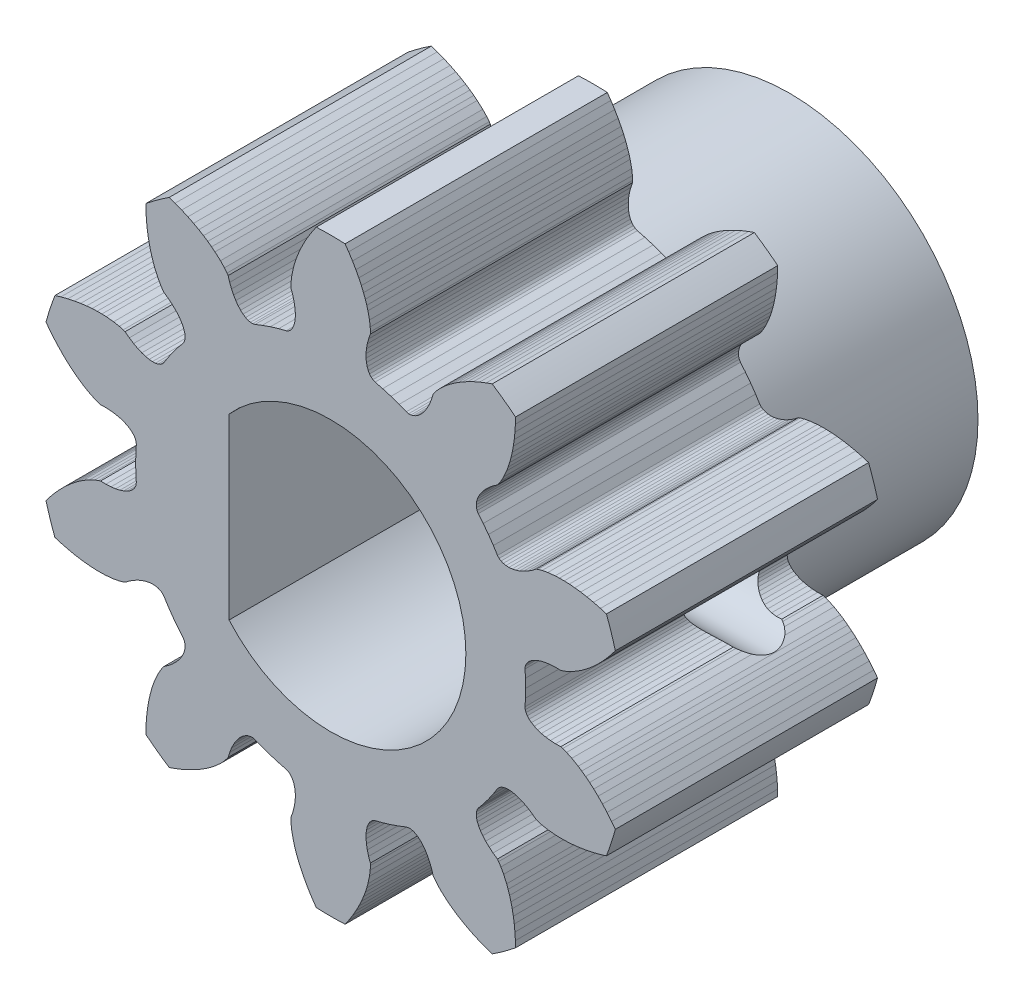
SolidWorks part; units mm, degrees
ref_plane "Piano frontale" through (0, 0, 0) normal (0, 0, 1) x (1, 0, 0)
ref_plane "Piano superiore" through (0, 0, 0) normal (0, 1, 0) x (1, 0, 0)
ref_plane "Piano destro" through (0, 0, 0) normal (1, 0, 0) x (0, 0, -1)
sketch "Model" plane through (0, 0, 0) normal (0, 0, 1) x (1, 0, 0)
  line L0 (84.3643, -6.8229) -> (84.3777, -6.6052)
  line L1 (84.3777, -6.6052) -> (84.399, -6.4007)
  line L2 (84.399, -6.4007) -> (84.427, -6.2092)
  line L3 (84.427, -6.2092) -> (84.4609, -6.0306)
  line L4 (84.4609, -6.0306) -> (84.499, -5.8673)
  line L5 (84.499, -5.8673) -> (84.5407, -5.7174)
  line L6 (84.5407, -5.7174) -> (84.5853, -5.5797)
  line L7 (84.5853, -5.5797) -> (84.6311, -5.4559)
  line L8 (84.6311, -5.4559) -> (84.7223, -5.2499)
  line L9 (84.7223, -5.2499) -> (84.8061, -5.0966)
  line L10 (84.8061, -5.0966) -> (84.8759, -4.9906)
  line L11 (84.8759, -4.9906) -> (84.9127, -4.9427)
  line L12 (84.9127, -4.9427) -> (85.0453, -4.8498)
  line L13 (85.0453, -4.8498) -> (85.1666, -4.7509)
  line L14 (85.1666, -4.7509) -> (85.2712, -4.6509)
  line L15 (85.2712, -4.6509) -> (85.359, -4.551)
  line L16 (85.359, -4.551) -> (85.4304, -4.4523)
  line L17 (85.4304, -4.4523) -> (85.4856, -4.3562)
  line L18 (85.4856, -4.3562) -> (85.525, -4.2638)
  line L19 (85.525, -4.2638) -> (85.549, -4.1762)
  line L20 (85.549, -4.1762) -> (85.5581, -4.0946)
  line L21 (85.5581, -4.0946) -> (85.5528, -4.02)
  line L22 (85.5528, -4.02) -> (85.5338, -3.9534)
  line L23 (85.5338, -3.9534) -> (85.4968, -3.8895)
  line L24 (85.4968, -3.8895) -> (85.346, -3.7071)
  line L25 (85.346, -3.7071) -> (85.1863, -3.4973)
  line L26 (85.1863, -3.4973) -> (85.0362, -3.2807)
  line L27 (85.0362, -3.2807) -> (84.9093, -3.0809)
  line L28 (84.9093, -3.0809) -> (84.8599, -3.026)
  line L29 (84.8599, -3.026) -> (84.8025, -2.9873)
  line L30 (84.8025, -2.9873) -> (84.7332, -2.9592)
  line L31 (84.7332, -2.9592) -> (84.6527, -2.9426)
  line L32 (84.6527, -2.9426) -> (84.562, -2.9384)
  line L33 (84.562, -2.9384) -> (84.462, -2.9473)
  line L34 (84.462, -2.9473) -> (84.3535, -2.9701)
  line L35 (84.3535, -2.9701) -> (84.2376, -3.0075)
  line L36 (84.2376, -3.0075) -> (84.1154, -3.0602)
  line L37 (84.1154, -3.0602) -> (83.988, -3.1287)
  line L38 (83.988, -3.1287) -> (83.8564, -3.2135)
  line L39 (83.8564, -3.2135) -> (83.7272, -3.3109)
  line L40 (83.7272, -3.3109) -> (83.6702, -3.3312)
  line L41 (83.6702, -3.3312) -> (83.5478, -3.3648)
  line L42 (83.5478, -3.3648) -> (83.3761, -3.397)
  line L43 (83.3761, -3.397) -> (83.152, -3.4201)
  line L44 (83.152, -3.4201) -> (83.0202, -3.4255)
  line L45 (83.0202, -3.4255) -> (82.8754, -3.4254)
  line L46 (82.8754, -3.4254) -> (82.72, -3.4187)
  line L47 (82.72, -3.4187) -> (82.5529, -3.4045)
  line L48 (82.5529, -3.4045) -> (82.3725, -3.3815)
  line L49 (82.3725, -3.3815) -> (82.1818, -3.349)
  line L50 (82.1818, -3.349) -> (81.9807, -3.306)
  line L51 (81.9807, -3.306) -> (81.7695, -3.2515)
  line L52 (81.7695, -3.2515) -> (81.5869, -3.1966)
  line L53 (81.3147, -2.359) -> (81.4302, -2.2072)
  line L54 (81.4302, -2.2072) -> (81.569, -2.039)
  line L55 (81.569, -2.039) -> (81.7064, -1.8861)
  line L56 (81.7064, -1.8861) -> (81.8417, -1.7476)
  line L57 (81.8417, -1.7476) -> (81.9741, -1.6231)
  line L58 (81.9741, -1.6231) -> (82.1009, -1.5133)
  line L59 (82.1009, -1.5133) -> (82.2227, -1.4165)
  line L60 (82.2227, -1.4165) -> (82.3397, -1.3313)
  line L61 (82.3397, -1.3313) -> (82.4496, -1.2582)
  line L62 (82.4496, -1.2582) -> (82.6445, -1.1451)
  line L63 (82.6445, -1.1451) -> (82.8023, -1.0703)
  line L64 (82.8023, -1.0703) -> (82.921, -1.0256)
  line L65 (82.921, -1.0256) -> (82.979, -1.0085)
  line L66 (82.979, -1.0085) -> (83.1409, -1.0113)
  line L67 (83.1409, -1.0113) -> (83.2972, -1.0026)
  line L68 (83.2972, -1.0026) -> (83.4406, -0.9831)
  line L69 (83.4406, -0.9831) -> (83.5704, -0.9539)
  line L70 (83.5704, -0.9539) -> (83.6861, -0.9161)
  line L71 (83.6861, -0.9161) -> (83.7873, -0.8708)
  line L72 (83.7873, -0.8708) -> (83.8735, -0.8192)
  line L73 (83.8735, -0.8192) -> (83.9443, -0.7624)
  line L74 (83.9443, -0.7624) -> (83.9997, -0.7017)
  line L75 (83.9997, -0.7017) -> (84.0392, -0.6382)
  line L76 (84.0392, -0.6382) -> (84.063, -0.5732)
  line L77 (84.063, -0.5732) -> (84.0707, -0.4998)
  line L78 (84.0707, -0.4998) -> (84.0558, -0.2635)
  line L79 (84.0558, -0.2635) -> (84.05, 0)
  line L80 (84.05, 0) -> (84.0558, 0.2635)
  line L81 (84.0558, 0.2635) -> (84.0707, 0.4998)
  line L82 (84.0707, 0.4998) -> (84.063, 0.5732)
  line L83 (84.063, 0.5732) -> (84.0392, 0.6382)
  line L84 (84.0392, 0.6382) -> (83.9997, 0.7017)
  line L85 (83.9997, 0.7017) -> (83.9443, 0.7624)
  line L86 (83.9443, 0.7624) -> (83.8735, 0.8192)
  line L87 (83.8735, 0.8192) -> (83.7873, 0.8708)
  line L88 (83.7873, 0.8708) -> (83.6861, 0.9161)
  line L89 (83.6861, 0.9161) -> (83.5704, 0.9539)
  line L90 (83.5704, 0.9539) -> (83.4406, 0.9831)
  line L91 (83.4406, 0.9831) -> (83.2972, 1.0026)
  line L92 (83.2972, 1.0026) -> (83.1409, 1.0113)
  line L93 (83.1409, 1.0113) -> (82.979, 1.0085)
  line L94 (82.979, 1.0085) -> (82.921, 1.0256)
  line L95 (82.921, 1.0256) -> (82.8023, 1.0703)
  line L96 (82.8023, 1.0703) -> (82.6445, 1.1451)
  line L97 (82.6445, 1.1451) -> (82.4496, 1.2582)
  line L98 (82.4496, 1.2582) -> (82.3397, 1.3313)
  line L99 (82.3397, 1.3313) -> (82.2227, 1.4165)
  line L100 (82.2227, 1.4165) -> (82.1009, 1.5133)
  line L101 (82.1009, 1.5133) -> (81.9741, 1.6231)
  line L102 (81.9741, 1.6231) -> (81.8417, 1.7476)
  line L103 (81.8417, 1.7476) -> (81.7064, 1.8861)
  line L104 (81.7064, 1.8861) -> (81.569, 2.039)
  line L105 (81.569, 2.039) -> (81.4302, 2.2072)
  line L106 (81.4302, 2.2072) -> (81.3147, 2.359)
  line L107 (81.5869, 3.1966) -> (81.7695, 3.2515)
  line L108 (81.7695, 3.2515) -> (81.9807, 3.306)
  line L109 (81.9807, 3.306) -> (82.1818, 3.349)
  line L110 (82.1818, 3.349) -> (82.3725, 3.3815)
  line L111 (82.3725, 3.3815) -> (82.5529, 3.4045)
  line L112 (82.5529, 3.4045) -> (82.72, 3.4187)
  line L113 (82.72, 3.4187) -> (82.8754, 3.4254)
  line L114 (82.8754, 3.4254) -> (83.0202, 3.4255)
  line L115 (83.0202, 3.4255) -> (83.152, 3.4201)
  line L116 (83.152, 3.4201) -> (83.3761, 3.397)
  line L117 (83.3761, 3.397) -> (83.5478, 3.3648)
  line L118 (83.5478, 3.3648) -> (83.6702, 3.3312)
  line L119 (83.6702, 3.3312) -> (83.7272, 3.3109)
  line L120 (83.7272, 3.3109) -> (83.8564, 3.2135)
  line L121 (83.8564, 3.2135) -> (83.988, 3.1287)
  line L122 (83.988, 3.1287) -> (84.1154, 3.0602)
  line L123 (84.1154, 3.0602) -> (84.2376, 3.0075)
  line L124 (84.2376, 3.0075) -> (84.3535, 2.9701)
  line L125 (84.3535, 2.9701) -> (84.462, 2.9473)
  line L126 (84.462, 2.9473) -> (84.562, 2.9384)
  line L127 (84.562, 2.9384) -> (84.6527, 2.9426)
  line L128 (84.6527, 2.9426) -> (84.7332, 2.9592)
  line L129 (84.7332, 2.9592) -> (84.8025, 2.9873)
  line L130 (84.8025, 2.9873) -> (84.8599, 3.026)
  line L131 (84.8599, 3.026) -> (84.9093, 3.0809)
  line L132 (84.9093, 3.0809) -> (85.0362, 3.2807)
  line L133 (85.0362, 3.2807) -> (85.1863, 3.4973)
  line L134 (85.1863, 3.4973) -> (85.346, 3.7071)
  line L135 (85.346, 3.7071) -> (85.4968, 3.8895)
  line L136 (85.4968, 3.8895) -> (85.5338, 3.9534)
  line L137 (85.5338, 3.9534) -> (85.5528, 4.02)
  line L138 (85.5528, 4.02) -> (85.5581, 4.0946)
  line L139 (85.5581, 4.0946) -> (85.549, 4.1762)
  line L140 (85.549, 4.1762) -> (85.525, 4.2638)
  line L141 (85.525, 4.2638) -> (85.4856, 4.3562)
  line L142 (85.4856, 4.3562) -> (85.4304, 4.4523)
  line L143 (85.4304, 4.4523) -> (85.359, 4.551)
  line L144 (85.359, 4.551) -> (85.2712, 4.6509)
  line L145 (85.2712, 4.6509) -> (85.1666, 4.7509)
  line L146 (85.1666, 4.7509) -> (85.0453, 4.8498)
  line L147 (85.0453, 4.8498) -> (84.9127, 4.9427)
  line L148 (84.9127, 4.9427) -> (84.8759, 4.9906)
  line L149 (84.8759, 4.9906) -> (84.8061, 5.0966)
  line L150 (84.8061, 5.0966) -> (84.7223, 5.2499)
  line L151 (84.7223, 5.2499) -> (84.6311, 5.4559)
  line L152 (84.6311, 5.4559) -> (84.5853, 5.5797)
  line L153 (84.5853, 5.5797) -> (84.5407, 5.7174)
  line L154 (84.5407, 5.7174) -> (84.499, 5.8673)
  line L155 (84.499, 5.8673) -> (84.4609, 6.0306)
  line L156 (84.4609, 6.0306) -> (84.427, 6.2092)
  line L157 (84.427, 6.2092) -> (84.399, 6.4007)
  line L158 (84.399, 6.4007) -> (84.3777, 6.6052)
  line L159 (84.3777, 6.6052) -> (84.3643, 6.8229)
  line L160 (84.3643, 6.8229) -> (84.36, 7.0135)
  line L161 (85.0726, 7.5312) -> (85.2526, 7.4683)
  line L162 (85.2526, 7.4683) -> (85.4555, 7.3882)
  line L163 (85.4555, 7.3882) -> (85.6434, 7.3048)
  line L164 (85.6434, 7.3048) -> (85.8168, 7.219)
  line L165 (85.8168, 7.219) -> (85.9762, 7.1316)
  line L166 (85.9762, 7.1316) -> (86.1198, 7.0448)
  line L167 (86.1198, 7.0448) -> (86.2495, 6.9589)
  line L168 (86.2495, 6.9589) -> (86.3667, 6.8739)
  line L169 (86.3667, 6.8739) -> (86.4702, 6.7921)
  line L170 (86.4702, 6.7921) -> (86.6379, 6.6417)
  line L171 (86.6379, 6.6417) -> (86.7578, 6.5147)
  line L172 (86.7578, 6.5147) -> (86.8371, 6.4155)
  line L173 (86.8371, 6.4155) -> (86.8713, 6.3657)
  line L174 (86.8713, 6.3657) -> (86.9186, 6.2109)
  line L175 (86.9186, 6.2109) -> (86.9752, 6.0649)
  line L176 (86.9752, 6.0649) -> (87.038, 5.9346)
  line L177 (87.038, 5.9346) -> (87.1059, 5.8201)
  line L178 (87.1059, 5.8201) -> (87.1776, 5.7218)
  line L179 (87.1776, 5.7218) -> (87.252, 5.6396)
  line L180 (87.252, 5.6396) -> (87.3277, 5.5735)
  line L181 (87.3277, 5.5735) -> (87.4036, 5.5237)
  line L182 (87.4036, 5.5237) -> (87.4785, 5.4898)
  line L183 (87.4785, 5.4898) -> (87.5511, 5.4718)
  line L184 (87.5511, 5.4718) -> (87.6202, 5.4693)
  line L185 (87.6202, 5.4693) -> (87.6924, 5.4847)
  line L186 (87.6924, 5.4847) -> (87.9125, 5.5718)
  line L187 (87.9125, 5.5718) -> (88.1613, 5.6588)
  line L188 (88.1613, 5.6588) -> (88.4138, 5.7347)
  line L189 (88.4138, 5.7347) -> (88.643, 5.7936)
  line L190 (88.643, 5.7936) -> (88.7105, 5.8236)
  line L191 (88.7105, 5.8236) -> (88.765, 5.8662)
  line L192 (88.765, 5.8662) -> (88.8131, 5.9235)
  line L193 (88.8131, 5.9235) -> (88.8538, 5.9949)
  line L194 (88.8538, 5.9949) -> (88.8859, 6.0798)
  line L195 (88.8859, 6.0798) -> (88.9083, 6.1777)
  line L196 (88.9083, 6.1777) -> (88.9202, 6.2879)
  line L197 (88.9202, 6.2879) -> (88.9204, 6.4097)
  line L198 (88.9204, 6.4097) -> (88.908, 6.5422)
  line L199 (88.908, 6.5422) -> (88.8823, 6.6846)
  line L200 (88.8823, 6.6846) -> (88.8422, 6.8359)
  line L201 (88.8422, 6.8359) -> (88.7895, 6.989)
  line L202 (88.7895, 6.989) -> (88.7879, 7.0494)
  line L203 (88.7879, 7.0494) -> (88.7937, 7.1762)
  line L204 (88.7937, 7.1762) -> (88.8161, 7.3494)
  line L205 (88.8161, 7.3494) -> (88.8634, 7.5697)
  line L206 (88.8634, 7.5697) -> (88.899, 7.6967)
  line L207 (88.899, 7.6967) -> (88.9439, 7.8344)
  line L208 (88.9439, 7.8344) -> (88.9983, 7.9801)
  line L209 (88.9983, 7.9801) -> (89.0635, 8.1347)
  line L210 (89.0635, 8.1347) -> (89.141, 8.2991)
  line L211 (89.141, 8.2991) -> (89.2309, 8.4705)
  line L212 (89.2309, 8.4705) -> (89.3339, 8.6484)
  line L213 (89.3339, 8.6484) -> (89.451, 8.8325)
  line L214 (89.451, 8.8325) -> (89.5596, 8.9892)
  line L215 (90.4404, 8.9892) -> (90.549, 8.8325)
  line L216 (90.549, 8.8325) -> (90.6661, 8.6484)
  line L217 (90.6661, 8.6484) -> (90.7691, 8.4705)
  line L218 (90.7691, 8.4705) -> (90.859, 8.2991)
  line L219 (90.859, 8.2991) -> (90.9365, 8.1347)
  line L220 (90.9365, 8.1347) -> (91.0017, 7.9801)
  line L221 (91.0017, 7.9801) -> (91.0561, 7.8344)
  line L222 (91.0561, 7.8344) -> (91.101, 7.6967)
  line L223 (91.101, 7.6967) -> (91.1366, 7.5697)
  line L224 (91.1366, 7.5697) -> (91.1839, 7.3494)
  line L225 (91.1839, 7.3494) -> (91.2063, 7.1762)
  line L226 (91.2063, 7.1762) -> (91.2121, 7.0494)
  line L227 (91.2121, 7.0494) -> (91.2105, 6.989)
  line L228 (91.2105, 6.989) -> (91.1578, 6.8359)
  line L229 (91.1578, 6.8359) -> (91.1177, 6.6846)
  line L230 (91.1177, 6.6846) -> (91.092, 6.5422)
  line L231 (91.092, 6.5422) -> (91.0796, 6.4097)
  line L232 (91.0796, 6.4097) -> (91.0798, 6.2879)
  line L233 (91.0798, 6.2879) -> (91.0917, 6.1777)
  line L234 (91.0917, 6.1777) -> (91.1141, 6.0798)
  line L235 (91.1141, 6.0798) -> (91.1462, 5.9949)
  line L236 (91.1462, 5.9949) -> (91.1869, 5.9235)
  line L237 (91.1869, 5.9235) -> (91.235, 5.8662)
  line L238 (91.235, 5.8662) -> (91.2895, 5.8236)
  line L239 (91.2895, 5.8236) -> (91.357, 5.7936)
  line L240 (91.357, 5.7936) -> (91.5862, 5.7347)
  line L241 (91.5862, 5.7347) -> (91.8387, 5.6588)
  line L242 (91.8387, 5.6588) -> (92.0875, 5.5718)
  line L243 (92.0875, 5.5718) -> (92.3076, 5.4847)
  line L244 (92.3076, 5.4847) -> (92.3798, 5.4693)
  line L245 (92.3798, 5.4693) -> (92.4489, 5.4718)
  line L246 (92.4489, 5.4718) -> (92.5215, 5.4898)
  line L247 (92.5215, 5.4898) -> (92.5964, 5.5237)
  line L248 (92.5964, 5.5237) -> (92.6723, 5.5735)
  line L249 (92.6723, 5.5735) -> (92.748, 5.6396)
  line L250 (92.748, 5.6396) -> (92.8224, 5.7218)
  line L251 (92.8224, 5.7218) -> (92.8941, 5.8201)
  line L252 (92.8941, 5.8201) -> (92.962, 5.9346)
  line L253 (92.962, 5.9346) -> (93.0248, 6.0649)
  line L254 (93.0248, 6.0649) -> (93.0814, 6.2109)
  line L255 (93.0814, 6.2109) -> (93.1287, 6.3657)
  line L256 (93.1287, 6.3657) -> (93.1629, 6.4155)
  line L257 (93.1629, 6.4155) -> (93.2422, 6.5147)
  line L258 (93.2422, 6.5147) -> (93.3621, 6.6417)
  line L259 (93.3621, 6.6417) -> (93.5298, 6.7921)
  line L260 (93.5298, 6.7921) -> (93.6333, 6.8739)
  line L261 (93.6333, 6.8739) -> (93.7505, 6.9589)
  line L262 (93.7505, 6.9589) -> (93.8802, 7.0448)
  line L263 (93.8802, 7.0448) -> (94.0238, 7.1316)
  line L264 (94.0238, 7.1316) -> (94.1832, 7.219)
  line L265 (94.1832, 7.219) -> (94.3566, 7.3048)
  line L266 (94.3566, 7.3048) -> (94.5445, 7.3882)
  line L267 (94.5445, 7.3882) -> (94.7474, 7.4683)
  line L268 (94.7474, 7.4683) -> (94.9274, 7.5312)
  line L269 (95.64, 7.0135) -> (95.6357, 6.8229)
  line L270 (95.6357, 6.8229) -> (95.6223, 6.6052)
  line L271 (95.6223, 6.6052) -> (95.601, 6.4007)
  line L272 (95.601, 6.4007) -> (95.573, 6.2092)
  line L273 (95.573, 6.2092) -> (95.5391, 6.0306)
  line L274 (95.5391, 6.0306) -> (95.501, 5.8673)
  line L275 (95.501, 5.8673) -> (95.4593, 5.7174)
  line L276 (95.4593, 5.7174) -> (95.4147, 5.5797)
  line L277 (95.4147, 5.5797) -> (95.3689, 5.4559)
  line L278 (95.3689, 5.4559) -> (95.2777, 5.2499)
  line L279 (95.2777, 5.2499) -> (95.1939, 5.0966)
  line L280 (95.1939, 5.0966) -> (95.1241, 4.9906)
  line L281 (95.1241, 4.9906) -> (95.0873, 4.9427)
  line L282 (95.0873, 4.9427) -> (94.9547, 4.8498)
  line L283 (94.9547, 4.8498) -> (94.8334, 4.7509)
  line L284 (94.8334, 4.7509) -> (94.7288, 4.6509)
  line L285 (94.7288, 4.6509) -> (94.641, 4.551)
  line L286 (94.641, 4.551) -> (94.5696, 4.4523)
  line L287 (94.5696, 4.4523) -> (94.5144, 4.3562)
  line L288 (94.5144, 4.3562) -> (94.475, 4.2638)
  line L289 (94.475, 4.2638) -> (94.451, 4.1762)
  line L290 (94.451, 4.1762) -> (94.4419, 4.0946)
  line L291 (94.4419, 4.0946) -> (94.4472, 4.02)
  line L292 (94.4472, 4.02) -> (94.4662, 3.9534)
  line L293 (94.4662, 3.9534) -> (94.5032, 3.8895)
  line L294 (94.5032, 3.8895) -> (94.654, 3.7071)
  line L295 (94.654, 3.7071) -> (94.8137, 3.4973)
  line L296 (94.8137, 3.4973) -> (94.9638, 3.2807)
  line L297 (94.9638, 3.2807) -> (95.0907, 3.0809)
  line L298 (95.0907, 3.0809) -> (95.1401, 3.026)
  line L299 (95.1401, 3.026) -> (95.1975, 2.9873)
  line L300 (95.1975, 2.9873) -> (95.2668, 2.9592)
  line L301 (95.2668, 2.9592) -> (95.3473, 2.9426)
  line L302 (95.3473, 2.9426) -> (95.438, 2.9384)
  line L303 (95.438, 2.9384) -> (95.538, 2.9473)
  line L304 (95.538, 2.9473) -> (95.6465, 2.9701)
  line L305 (95.6465, 2.9701) -> (95.7624, 3.0075)
  line L306 (95.7624, 3.0075) -> (95.8846, 3.0602)
  line L307 (95.8846, 3.0602) -> (96.012, 3.1287)
  line L308 (96.012, 3.1287) -> (96.1436, 3.2135)
  line L309 (96.1436, 3.2135) -> (96.2728, 3.3109)
  line L310 (96.2728, 3.3109) -> (96.3298, 3.3312)
  line L311 (96.3298, 3.3312) -> (96.4522, 3.3648)
  line L312 (96.4522, 3.3648) -> (96.6239, 3.397)
  line L313 (96.6239, 3.397) -> (96.848, 3.4201)
  line L314 (96.848, 3.4201) -> (96.9798, 3.4255)
  line L315 (96.9798, 3.4255) -> (97.1246, 3.4254)
  line L316 (97.1246, 3.4254) -> (97.28, 3.4187)
  line L317 (97.28, 3.4187) -> (97.4471, 3.4045)
  line L318 (97.4471, 3.4045) -> (97.6275, 3.3815)
  line L319 (97.6275, 3.3815) -> (97.8182, 3.349)
  line L320 (97.8182, 3.349) -> (98.0193, 3.306)
  line L321 (98.0193, 3.306) -> (98.2305, 3.2515)
  line L322 (98.2305, 3.2515) -> (98.4131, 3.1966)
  line L323 (98.6853, 2.359) -> (98.5698, 2.2072)
  line L324 (98.5698, 2.2072) -> (98.431, 2.039)
  line L325 (98.431, 2.039) -> (98.2936, 1.8861)
  line L326 (98.2936, 1.8861) -> (98.1583, 1.7476)
  line L327 (98.1583, 1.7476) -> (98.0259, 1.6231)
  line L328 (98.0259, 1.6231) -> (97.8991, 1.5133)
  line L329 (97.8991, 1.5133) -> (97.7773, 1.4165)
  line L330 (97.7773, 1.4165) -> (97.6603, 1.3313)
  line L331 (97.6603, 1.3313) -> (97.5504, 1.2582)
  line L332 (97.5504, 1.2582) -> (97.3555, 1.1451)
  line L333 (97.3555, 1.1451) -> (97.1977, 1.0703)
  line L334 (97.1977, 1.0703) -> (97.079, 1.0256)
  line L335 (97.079, 1.0256) -> (97.021, 1.0085)
  line L336 (97.021, 1.0085) -> (96.8591, 1.0113)
  line L337 (96.8591, 1.0113) -> (96.7028, 1.0026)
  line L338 (96.7028, 1.0026) -> (96.5594, 0.9831)
  line L339 (96.5594, 0.9831) -> (96.4296, 0.9539)
  line L340 (96.4296, 0.9539) -> (96.3139, 0.9161)
  line L341 (96.3139, 0.9161) -> (96.2127, 0.8708)
  line L342 (96.2127, 0.8708) -> (96.1265, 0.8192)
  line L343 (96.1265, 0.8192) -> (96.0557, 0.7624)
  line L344 (96.0557, 0.7624) -> (96.0003, 0.7017)
  line L345 (96.0003, 0.7017) -> (95.9608, 0.6382)
  line L346 (95.9608, 0.6382) -> (95.937, 0.5732)
  line L347 (95.937, 0.5732) -> (95.9293, 0.4998)
  line L348 (95.9293, 0.4998) -> (95.9442, 0.2635)
  line L349 (95.9442, 0.2635) -> (95.95, 0)
  line L350 (95.95, 0) -> (95.9442, -0.2635)
  line L351 (95.9442, -0.2635) -> (95.9293, -0.4998)
  line L352 (95.9293, -0.4998) -> (95.937, -0.5732)
  line L353 (95.937, -0.5732) -> (95.9608, -0.6382)
  line L354 (95.9608, -0.6382) -> (96.0003, -0.7017)
  line L355 (96.0003, -0.7017) -> (96.0557, -0.7624)
  line L356 (96.0557, -0.7624) -> (96.1265, -0.8192)
  line L357 (96.1265, -0.8192) -> (96.2127, -0.8708)
  line L358 (96.2127, -0.8708) -> (96.3139, -0.9161)
  line L359 (96.3139, -0.9161) -> (96.4296, -0.9539)
  line L360 (96.4296, -0.9539) -> (96.5594, -0.9831)
  line L361 (96.5594, -0.9831) -> (96.7028, -1.0026)
  line L362 (96.7028, -1.0026) -> (96.8591, -1.0113)
  line L363 (96.8591, -1.0113) -> (97.021, -1.0085)
  line L364 (97.021, -1.0085) -> (97.079, -1.0256)
  line L365 (97.079, -1.0256) -> (97.1977, -1.0703)
  line L366 (97.1977, -1.0703) -> (97.3555, -1.1451)
  line L367 (97.3555, -1.1451) -> (97.5504, -1.2582)
  line L368 (97.5504, -1.2582) -> (97.6603, -1.3313)
  line L369 (97.6603, -1.3313) -> (97.7773, -1.4165)
  line L370 (97.7773, -1.4165) -> (97.8991, -1.5133)
  line L371 (97.8991, -1.5133) -> (98.0259, -1.6231)
  line L372 (98.0259, -1.6231) -> (98.1583, -1.7476)
  line L373 (98.1583, -1.7476) -> (98.2936, -1.8861)
  line L374 (98.2936, -1.8861) -> (98.431, -2.039)
  line L375 (98.431, -2.039) -> (98.5698, -2.2072)
  line L376 (98.5698, -2.2072) -> (98.6853, -2.359)
  line L377 (98.4131, -3.1966) -> (98.2305, -3.2515)
  line L378 (98.2305, -3.2515) -> (98.0193, -3.306)
  line L379 (98.0193, -3.306) -> (97.8182, -3.349)
  line L380 (97.8182, -3.349) -> (97.6275, -3.3815)
  line L381 (97.6275, -3.3815) -> (97.4471, -3.4045)
  line L382 (97.4471, -3.4045) -> (97.28, -3.4187)
  line L383 (97.28, -3.4187) -> (97.1246, -3.4254)
  line L384 (97.1246, -3.4254) -> (96.9798, -3.4255)
  line L385 (96.9798, -3.4255) -> (96.848, -3.4201)
  line L386 (96.848, -3.4201) -> (96.6239, -3.397)
  line L387 (96.6239, -3.397) -> (96.4522, -3.3648)
  line L388 (96.4522, -3.3648) -> (96.3298, -3.3312)
  line L389 (96.3298, -3.3312) -> (96.2728, -3.3109)
  line L390 (96.2728, -3.3109) -> (96.1436, -3.2135)
  line L391 (96.1436, -3.2135) -> (96.012, -3.1287)
  line L392 (96.012, -3.1287) -> (95.8846, -3.0602)
  line L393 (95.8846, -3.0602) -> (95.7624, -3.0075)
  line L394 (95.7624, -3.0075) -> (95.6465, -2.9701)
  line L395 (95.6465, -2.9701) -> (95.538, -2.9473)
  line L396 (95.538, -2.9473) -> (95.438, -2.9384)
  line L397 (95.438, -2.9384) -> (95.3473, -2.9426)
  line L398 (95.3473, -2.9426) -> (95.2668, -2.9592)
  line L399 (95.2668, -2.9592) -> (95.1975, -2.9873)
  line L400 (95.1975, -2.9873) -> (95.1401, -3.026)
  line L401 (95.1401, -3.026) -> (95.0907, -3.0809)
  line L402 (95.0907, -3.0809) -> (94.9638, -3.2807)
  line L403 (94.9638, -3.2807) -> (94.8137, -3.4973)
  line L404 (94.8137, -3.4973) -> (94.654, -3.7071)
  line L405 (94.654, -3.7071) -> (94.5032, -3.8895)
  line L406 (94.5032, -3.8895) -> (94.4662, -3.9534)
  line L407 (94.4662, -3.9534) -> (94.4472, -4.02)
  line L408 (94.4472, -4.02) -> (94.4419, -4.0946)
  line L409 (94.4419, -4.0946) -> (94.451, -4.1762)
  line L410 (94.451, -4.1762) -> (94.475, -4.2638)
  line L411 (94.475, -4.2638) -> (94.5144, -4.3562)
  line L412 (94.5144, -4.3562) -> (94.5696, -4.4523)
  line L413 (94.5696, -4.4523) -> (94.641, -4.551)
  line L414 (94.641, -4.551) -> (94.7288, -4.6509)
  line L415 (94.7288, -4.6509) -> (94.8334, -4.7509)
  line L416 (94.8334, -4.7509) -> (94.9547, -4.8498)
  line L417 (94.9547, -4.8498) -> (95.0873, -4.9427)
  line L418 (95.0873, -4.9427) -> (95.1241, -4.9906)
  line L419 (95.1241, -4.9906) -> (95.1939, -5.0966)
  line L420 (95.1939, -5.0966) -> (95.2777, -5.2499)
  line L421 (95.2777, -5.2499) -> (95.3689, -5.4559)
  line L422 (95.3689, -5.4559) -> (95.4147, -5.5797)
  line L423 (95.4147, -5.5797) -> (95.4593, -5.7174)
  line L424 (95.4593, -5.7174) -> (95.501, -5.8673)
  line L425 (95.501, -5.8673) -> (95.5391, -6.0306)
  line L426 (95.5391, -6.0306) -> (95.573, -6.2092)
  line L427 (95.573, -6.2092) -> (95.601, -6.4007)
  line L428 (95.601, -6.4007) -> (95.6223, -6.6052)
  line L429 (95.6223, -6.6052) -> (95.6357, -6.8229)
  line L430 (95.6357, -6.8229) -> (95.64, -7.0135)
  line L431 (94.9274, -7.5312) -> (94.7474, -7.4683)
  line L432 (94.7474, -7.4683) -> (94.5445, -7.3882)
  line L433 (94.5445, -7.3882) -> (94.3566, -7.3048)
  line L434 (94.3566, -7.3048) -> (94.1832, -7.219)
  line L435 (94.1832, -7.219) -> (94.0238, -7.1316)
  line L436 (94.0238, -7.1316) -> (93.8802, -7.0448)
  line L437 (93.8802, -7.0448) -> (93.7505, -6.9589)
  line L438 (93.7505, -6.9589) -> (93.6333, -6.8739)
  line L439 (93.6333, -6.8739) -> (93.5298, -6.7921)
  line L440 (93.5298, -6.7921) -> (93.3621, -6.6417)
  line L441 (93.3621, -6.6417) -> (93.2422, -6.5147)
  line L442 (93.2422, -6.5147) -> (93.1629, -6.4155)
  line L443 (93.1629, -6.4155) -> (93.1287, -6.3657)
  line L444 (93.1287, -6.3657) -> (93.0814, -6.2109)
  line L445 (93.0814, -6.2109) -> (93.0248, -6.0649)
  line L446 (93.0248, -6.0649) -> (92.962, -5.9346)
  line L447 (92.962, -5.9346) -> (92.8941, -5.8201)
  line L448 (92.8941, -5.8201) -> (92.8224, -5.7218)
  line L449 (92.8224, -5.7218) -> (92.748, -5.6396)
  line L450 (92.748, -5.6396) -> (92.6723, -5.5735)
  line L451 (92.6723, -5.5735) -> (92.5964, -5.5237)
  line L452 (92.5964, -5.5237) -> (92.5215, -5.4898)
  line L453 (92.5215, -5.4898) -> (92.4489, -5.4718)
  line L454 (92.4489, -5.4718) -> (92.3798, -5.4693)
  line L455 (92.3798, -5.4693) -> (92.3076, -5.4847)
  line L456 (92.3076, -5.4847) -> (92.0875, -5.5718)
  line L457 (92.0875, -5.5718) -> (91.8387, -5.6588)
  line L458 (91.8387, -5.6588) -> (91.5862, -5.7347)
  line L459 (91.5862, -5.7347) -> (91.357, -5.7936)
  line L460 (91.357, -5.7936) -> (91.2895, -5.8236)
  line L461 (91.2895, -5.8236) -> (91.235, -5.8662)
  line L462 (91.235, -5.8662) -> (91.1869, -5.9235)
  line L463 (91.1869, -5.9235) -> (91.1462, -5.9949)
  line L464 (91.1462, -5.9949) -> (91.1141, -6.0798)
  line L465 (91.1141, -6.0798) -> (91.0917, -6.1777)
  line L466 (91.0917, -6.1777) -> (91.0798, -6.2879)
  line L467 (91.0798, -6.2879) -> (91.0796, -6.4097)
  line L468 (91.0796, -6.4097) -> (91.092, -6.5422)
  line L469 (91.092, -6.5422) -> (91.1177, -6.6846)
  line L470 (91.1177, -6.6846) -> (91.1578, -6.8359)
  line L471 (91.1578, -6.8359) -> (91.2105, -6.989)
  line L472 (91.2105, -6.989) -> (91.2121, -7.0494)
  line L473 (91.2121, -7.0494) -> (91.2063, -7.1762)
  line L474 (91.2063, -7.1762) -> (91.1839, -7.3494)
  line L475 (91.1839, -7.3494) -> (91.1366, -7.5697)
  line L476 (91.1366, -7.5697) -> (91.101, -7.6967)
  line L477 (91.101, -7.6967) -> (91.0561, -7.8344)
  line L478 (91.0561, -7.8344) -> (91.0017, -7.9801)
  line L479 (91.0017, -7.9801) -> (90.9365, -8.1347)
  line L480 (90.9365, -8.1347) -> (90.859, -8.2991)
  line L481 (90.859, -8.2991) -> (90.7691, -8.4705)
  line L482 (90.7691, -8.4705) -> (90.6661, -8.6484)
  line L483 (90.6661, -8.6484) -> (90.549, -8.8325)
  line L484 (90.549, -8.8325) -> (90.4404, -8.9892)
  line L485 (89.5596, -8.9892) -> (89.451, -8.8325)
  line L486 (89.451, -8.8325) -> (89.3339, -8.6484)
  line L487 (89.3339, -8.6484) -> (89.2309, -8.4705)
  line L488 (89.2309, -8.4705) -> (89.141, -8.2991)
  line L489 (89.141, -8.2991) -> (89.0635, -8.1347)
  line L490 (89.0635, -8.1347) -> (88.9983, -7.9801)
  line L491 (88.9983, -7.9801) -> (88.9439, -7.8344)
  line L492 (88.9439, -7.8344) -> (88.899, -7.6967)
  line L493 (88.899, -7.6967) -> (88.8634, -7.5697)
  line L494 (88.8634, -7.5697) -> (88.8161, -7.3494)
  line L495 (88.8161, -7.3494) -> (88.7937, -7.1762)
  line L496 (88.7937, -7.1762) -> (88.7879, -7.0494)
  line L497 (88.7879, -7.0494) -> (88.7895, -6.989)
  line L498 (88.7895, -6.989) -> (88.8422, -6.8359)
  line L499 (88.8422, -6.8359) -> (88.8823, -6.6846)
  line L500 (88.8823, -6.6846) -> (88.908, -6.5422)
  line L501 (88.908, -6.5422) -> (88.9204, -6.4097)
  line L502 (88.9204, -6.4097) -> (88.9202, -6.2879)
  line L503 (88.9202, -6.2879) -> (88.9083, -6.1777)
  line L504 (88.9083, -6.1777) -> (88.8859, -6.0798)
  line L505 (88.8859, -6.0798) -> (88.8538, -5.9949)
  line L506 (88.8538, -5.9949) -> (88.8131, -5.9235)
  line L507 (88.8131, -5.9235) -> (88.765, -5.8662)
  line L508 (88.765, -5.8662) -> (88.7105, -5.8236)
  line L509 (88.7105, -5.8236) -> (88.643, -5.7936)
  line L510 (88.643, -5.7936) -> (88.4138, -5.7347)
  line L511 (88.4138, -5.7347) -> (88.1613, -5.6588)
  line L512 (88.1613, -5.6588) -> (87.9125, -5.5718)
  line L513 (87.9125, -5.5718) -> (87.6924, -5.4847)
  line L514 (87.6924, -5.4847) -> (87.6202, -5.4693)
  line L515 (87.6202, -5.4693) -> (87.5511, -5.4718)
  line L516 (87.5511, -5.4718) -> (87.4785, -5.4898)
  line L517 (87.4785, -5.4898) -> (87.4036, -5.5237)
  line L518 (87.4036, -5.5237) -> (87.3277, -5.5735)
  line L519 (87.3277, -5.5735) -> (87.252, -5.6396)
  line L520 (87.252, -5.6396) -> (87.1776, -5.7218)
  line L521 (87.1776, -5.7218) -> (87.1059, -5.8201)
  line L522 (87.1059, -5.8201) -> (87.038, -5.9346)
  line L523 (87.038, -5.9346) -> (86.9752, -6.0649)
  line L524 (86.9752, -6.0649) -> (86.9186, -6.2109)
  line L525 (86.9186, -6.2109) -> (86.8713, -6.3657)
  line L526 (86.8713, -6.3657) -> (86.8371, -6.4155)
  line L527 (86.8371, -6.4155) -> (86.7578, -6.5147)
  line L528 (86.7578, -6.5147) -> (86.6379, -6.6417)
  line L529 (86.6379, -6.6417) -> (86.4702, -6.7921)
  line L530 (86.4702, -6.7921) -> (86.3667, -6.8739)
  line L531 (86.3667, -6.8739) -> (86.2495, -6.9589)
  line L532 (86.2495, -6.9589) -> (86.1198, -7.0448)
  line L533 (86.1198, -7.0448) -> (85.9762, -7.1316)
  line L534 (85.9762, -7.1316) -> (85.8168, -7.219)
  line L535 (85.8168, -7.219) -> (85.6434, -7.3048)
  line L536 (85.6434, -7.3048) -> (85.4555, -7.3882)
  line L537 (85.4555, -7.3882) -> (85.2526, -7.4683)
  line L538 (85.2526, -7.4683) -> (85.0726, -7.5312)
  line L539 (84.36, -7.0135) -> (84.3643, -6.8229)
  arc A0 (81.3147, -2.359) -> (81.5869, -3.1966) centre (90.0001, 0) ccw
  arc A1 (81.5869, 3.1966) -> (81.3147, 2.359) centre (90.0001, 0) ccw
  arc A2 (85.0726, 7.5312) -> (84.36, 7.0135) centre (90, 0) ccw
  arc A3 (90.4404, 8.9892) -> (89.5596, 8.9892) centre (90, -0.0001) ccw
  arc A4 (95.64, 7.0135) -> (94.9274, 7.5312) centre (90, 0) ccw
  arc A5 (98.6853, 2.359) -> (98.4131, 3.1966) centre (89.9999, 0) ccw
  arc A6 (98.4131, -3.1966) -> (98.6853, -2.359) centre (89.9999, 0) ccw
  arc A7 (94.9274, -7.5312) -> (95.64, -7.0135) centre (90, 0) ccw
  arc A8 (89.5596, -8.9892) -> (90.4404, -8.9892) centre (90, 0.0001) ccw
  arc A9 (84.36, -7.0135) -> (85.0726, -7.5312) centre (90, 0) ccw
extrude "Estrusione-Estrusione1" add sketch "Model" along normal blind 8
sketch "Schizzo3" plane through (0, 0, 0) normal (0, 0, -1) x (-1, 0, 0)
  line L0 (-90, 8.9999) -> (-90, -8.9999) construction
  arc A0 (-89.5596, 8.9892) -> (-90.4404, 8.9892) centre (-90, -0.0001) ccw construction
  arc A1 (-90.4404, -8.9892) -> (-89.5596, -8.9892) centre (-90, 0.0001) ccw construction
  circle A2 centre (-90, 0) radius 5.75
  dimension "D1" = 11.5
extrude "Estrusione-Estrusione2" add sketch "Schizzo3" along normal blind 6
sketch "Schizzo4" plane through (0, 0, -6) normal (0, 0, -1) x (-1, 0, 0)
  line L0 (-86.9, 2.7213) -> (-86.9, -2.7213)
  arc A0 (-86.9, 2.7213) -> (-86.9, -2.7213) centre (-90, 0) ccw
  dimension "D1" = 8.25
  dimension "D2" = 3.1
extrude "Taglio-Estrusione1" cut sketch "Schizzo4" against normal through all
sketch "Schizzo5" plane through (86.9, 0, 0) normal (1, 0, 0) x (0, 0, -1)
  line L0 (-7, 0) -> (6, 0) construction
  line L2 (6, -4.125) -> (6, 4.125) construction
  line L3 (6, -2.7213) -> (6, 2.7213) construction
  circle A0 centre (-2, 0) radius 1.25
  point P8 (7, 0)
  dimension "D2" = 2.5
  dimension "D1" = 8
extrude "Taglio-Estrusione2" cut sketch "Schizzo5" against normal through all and the other way through all
